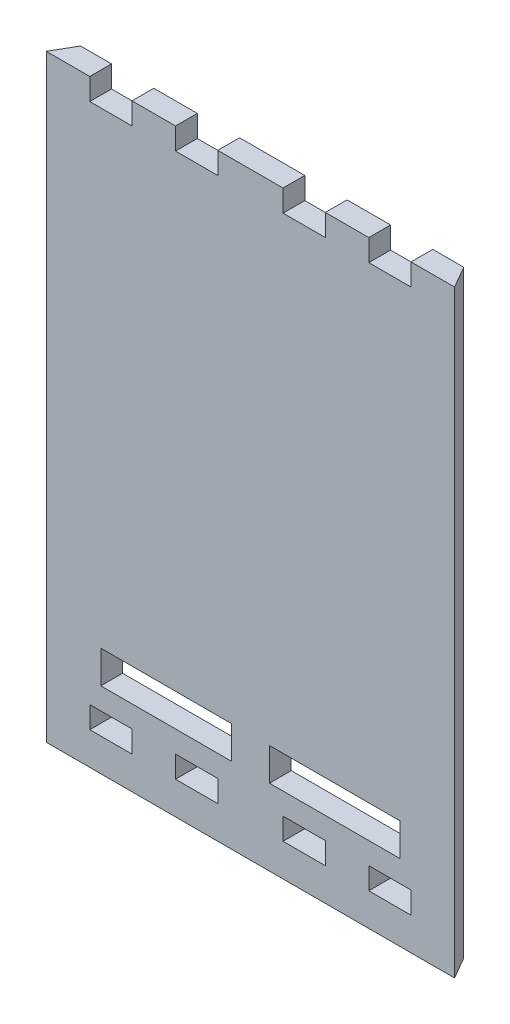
SolidWorks part; units mm, degrees
ref_plane "Front Plane" through (0, 0, 0) normal (0, 0, 1) x (1, 0, 0)
ref_plane "Top Plane" through (0, 0, 0) normal (0, 1, 0) x (1, 0, 0)
ref_plane "Right Plane" through (0, 0, 0) normal (1, 0, 0) x (0, 0, -1)
sketch "Sketch1" plane through (0, 0, 0) normal (0, 0, 1) x (1, 0, 0)
  line L0 (18.7639, 0) -> (18.7639, 50) construction
  line L1 (4, 0) -> (7.8819, 0)
  line L2 (0, 0) -> (0, 50)
  line L3 (0, 50) -> (37.5278, 50)
  line L4 (37.5278, 0) -> (37.5278, 50)
  line L5 (0, 0) -> (4, 0) construction
  line L6 (0, 0) -> (0, -2)
  line L7 (0, -2) -> (4, -2) construction
  line L8 (4, 0) -> (4, -2)
  line L9 (7.8819, 0) -> (11.8819, 0) construction
  line L10 (7.8819, 0) -> (7.8819, -2)
  line L11 (7.8819, -2) -> (11.8819, -2) construction
  line L12 (11.8819, 0) -> (11.8819, -2)
  line L13 (15.7639, 0) -> (21.7639, 0) construction
  line L14 (15.7639, 0) -> (15.7639, -2)
  line L15 (15.7639, -2) -> (21.7639, -2) construction
  line L17 (7.8819, 0) -> (11.8819, 0) construction
  line L18 (11.8819, 0) -> (15.7639, 0)
  line L19 (15.7639, 0) -> (21.7639, 0) construction
  line L21 (0, 0) -> (4, 0) construction
  line L22 (37.5278, 0) -> (33.5278, 0) construction
  line L23 (29.6458, 0) -> (25.6458, 0) construction
  line L24 (29.6458, 0) -> (25.6458, 0) construction
  line L25 (37.5278, 0) -> (33.5278, 0) construction
  line L26 (25.6458, 0) -> (21.7639, 0)
  line L27 (21.7639, 0) -> (21.7639, -2)
  line L28 (25.6458, 0) -> (25.6458, -2)
  line L29 (29.6458, -2) -> (25.6458, -2) construction
  line L30 (29.6458, 0) -> (29.6458, -2)
  line L31 (33.5278, 0) -> (33.5278, -2)
  line L32 (37.5278, -2) -> (33.5278, -2) construction
  line L33 (37.5278, 0) -> (37.5278, -2)
  line L34 (33.5278, 0) -> (29.6458, 0)
  line L35 (0, -2) -> (0, -5)
  line L36 (56.2917, 83.827) -> (37.5278, 116.327) construction
  line L37 (37.5278, 116.327) -> (0, 116.327) construction
  line L38 (0, 116.327) -> (-18.7639, 83.827) construction
  line L39 (-18.7639, 83.827) -> (0, 51.327) construction
  line L40 (0, 51.327) -> (37.5278, 51.327) construction
  line L41 (37.5278, 51.327) -> (56.2917, 83.827) construction
  line L42 (0, -5) -> (37.5278, -5)
  line L43 (37.5278, -5) -> (37.5278, -2)
  line L44 (4, -2) -> (7.8819, -2)
  line L45 (11.8819, -2) -> (15.7639, -2)
  line L46 (21.7639, -2) -> (25.6458, -2)
  line L47 (29.6458, -2) -> (33.5278, -2)
  line L52 (29.6458, 50) -> (25.6458, 50) construction
  line L56 (29.6458, 48) -> (25.6458, 48) construction
  line L65 (29.6458, 48) -> (25.6458, 48) construction
  line L73 (18.7639, 25) -> (25.6458, 25) construction
  line L74 (18.7639, 24) -> (25.8908, 24) construction
  line L75 (15.7639, 48) -> (21.7639, 48) construction
  line L76 (7.8819, 48) -> (11.8819, 48) construction
  line L77 (15.7639, 50) -> (21.7639, 50) construction
  line L78 (15.7639, 48) -> (21.7639, 48) construction
  line L79 (7.8819, 50) -> (11.8819, 50) construction
  line L80 (7.8819, 48) -> (11.8819, 48) construction
  line L81 (29.6458, 50) -> (33.5278, 50)
  line L82 (21.7639, 50) -> (25.6458, 50)
  line L83 (11.8819, 50) -> (15.7639, 50)
  line L84 (4, 50) -> (7.8819, 50)
  line L85 (33.5278, 48) -> (29.6458, 48)
  line L86 (33.5278, 48) -> (33.5278, 50)
  line L87 (29.6458, 48) -> (29.6458, 50)
  line L88 (25.6458, 48) -> (25.6458, 50)
  line L89 (21.7639, 48) -> (21.7639, 50)
  line L90 (25.6458, 48) -> (21.7639, 48)
  line L91 (11.8819, 48) -> (15.7639, 48)
  line L92 (15.7639, 48) -> (15.7639, 50)
  line L93 (11.8819, 48) -> (11.8819, 50)
  line L94 (7.8819, 48) -> (7.8819, 50)
  line L95 (4, 48) -> (4, 50)
  line L96 (4, 48) -> (7.8819, 48)
  circle A0 centre (18.7639, 83.827) radius 32.5 construction
  point P52 (18.7639, 25)
extrude "Boss-Extrude1" add sketch "Sketch1" along normal blind 2 contours L42 L43 L33 L4 L3 L2 L6 L35 L47 L30 L34 L31 L46 L27 L26 L28 L45 L12 L18 L14 L44 L8 L1 L10
sketch "Sketch2" plane through (0, 50, 0) normal (0, 1, 0) x (1, 0, 0)
  line L0 (2, -2) -> (2, 0) construction
  line L1 (1.1547, 0) -> (0, -2)
  line L4 (0, -2) -> (0, 0)
  line L5 (0, 0) -> (1.1547, 0)
  line L6 (37.5278, 0) -> (36.3731, 0)
  line L7 (37.5278, -2) -> (37.5278, 0)
  line L8 (36.3731, 0) -> (37.5278, -2)
  line L9 (0, 0) -> (4, 0) construction
  line L10 (0, -2) -> (0, 0) construction
  line L11 (0, -2) -> (4, -2) construction
  dimension "D1" = 30
extrude "Cut-Extrude1" cut sketch "Sketch2" against normal through all
sketch "Sketch4" plane through (0, 0, 2) normal (0, 0, 1) x (1, 0, 0)
  line L0 (0, -5) -> (37.5278, -5) construction
  line L1 (5.0139, 2) -> (17.0139, 2)
  line L2 (5.0139, 2) -> (5.0139, 5)
  line L3 (5.0139, 5) -> (17.0139, 5)
  line L4 (17.0139, 2) -> (17.0139, 5)
  line L5 (18.7639, -5) -> (18.7639, -1.67) construction
  line L6 (11.8819, 0) -> (15.7639, 0) construction
  line L7 (20.5139, 2) -> (20.5139, 5)
  line L8 (32.5139, 5) -> (20.5139, 5)
  line L9 (32.5139, 2) -> (32.5139, 5)
  line L10 (32.5139, 2) -> (20.5139, 2)
  line L11 (0, -5) -> (0, 4) construction
  point P6 (11.0139, 2)
  point P8 (18.7639, -5)
  point P16 (26.5139, 2)
  dimension "D1" = 12
  dimension "D2" = 3
  dimension "D3" = 2
  dimension "D4" = 1.75
  dimension "D5" = 5.0139
extrude "Cut-Extrude3" cut sketch "Sketch4" against normal blind 2
sketch "Sketch3" plane through (0, 0, 2) normal (0, 0, 1) x (1, 0, 0)
  line L0 (0, -5) -> (37.5278, -5) construction
  line L6 (18.7639, -5) -> (18.7639, 50) construction
  line L8 (0, 50) -> (4, 50) construction
  line L33 (23.618, 22.5) -> (23.618, 17.5)
  line L34 (11.9098, 42.5) -> (13.9098, 42.5)
  line L35 (11.9098, 42.5) -> (11.9098, 37.5)
  line L36 (11.9098, 37.5) -> (13.9098, 37.5)
  line L37 (13.9098, 42.5) -> (13.9098, 37.5)
  line L38 (11.9098, 32.5) -> (13.9098, 32.5)
  line L39 (11.9098, 32.5) -> (11.9098, 27.5)
  line L40 (11.9098, 27.5) -> (13.9098, 27.5)
  line L41 (13.9098, 32.5) -> (13.9098, 27.5)
  line L42 (11.9098, 22.5) -> (13.9098, 22.5)
  line L43 (11.9098, 22.5) -> (11.9098, 17.5)
  line L44 (11.9098, 17.5) -> (13.9098, 17.5)
  line L45 (13.9098, 22.5) -> (13.9098, 17.5)
  line L46 (25.618, 17.5) -> (23.618, 17.5)
  line L47 (25.618, 22.5) -> (25.618, 17.5)
  line L48 (25.618, 22.5) -> (23.618, 22.5)
  line L49 (23.618, 32.5) -> (23.618, 27.5)
  line L50 (25.618, 27.5) -> (23.618, 27.5)
  line L51 (25.618, 32.5) -> (25.618, 27.5)
  line L52 (25.618, 32.5) -> (23.618, 32.5)
  line L53 (23.618, 42.5) -> (23.618, 37.5)
  line L54 (25.618, 37.5) -> (23.618, 37.5)
  line L55 (25.618, 42.5) -> (25.618, 37.5)
  line L56 (25.618, 42.5) -> (23.618, 42.5)
  line L57 (24.618, 42.5) -> (24.618, 50) construction
extrude "Cut-Extrude2" [suppressed] cut sketch "Sketch3" against normal blind 2
equation "\"thkness\"= 2mm"
equation "\"size\"= 65mm"
equation "\"side_len\"= \"size\" / (2 * sin ( 60 ) )"
equation "\"D6@Sketch1\"=\"thkness\""
equation "\"D1@Boss-Extrude1\"=\"thkness\""
equation "\"D1@Sketch1\"=\"size\""
equation "\"height\"= 50mm"
equation "\"D2@Sketch1\"=\"height\""
equation "\"D8@Sketch1\"=\"thkness\"/2"
